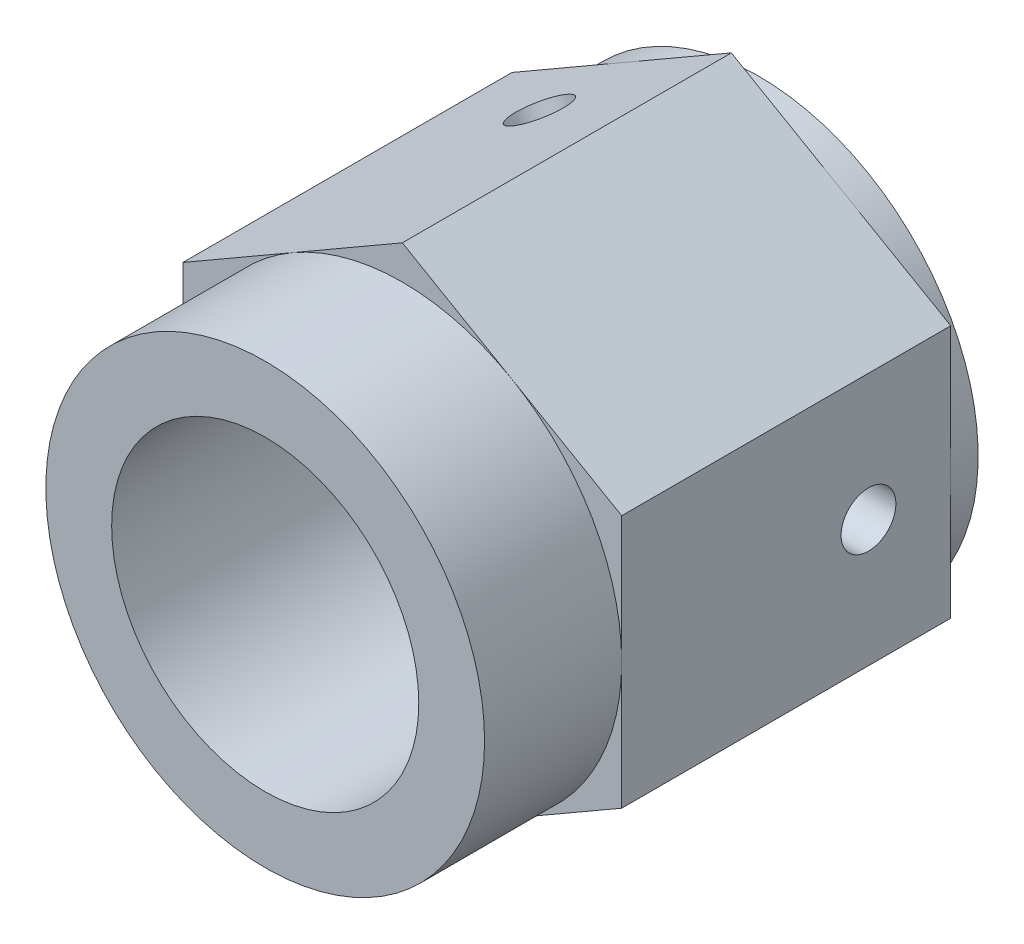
SolidWorks part; units mm, degrees
ref_plane "前视基准面" through (0, 0, 0) normal (0, 0, 1) x (1, 0, 0)
ref_plane "上视基准面" through (0, 0, 0) normal (0, 1, 0) x (1, 0, 0)
ref_plane "右视基准面" through (0, 0, 0) normal (1, 0, 0) x (0, 0, -1)
sketch "草图1" plane through (0, 0, 0) normal (0, 0, 1) x (1, 0, 0)
  line L1 (0, 46.188) -> (-40, 23.094)
  line L2 (-40, 23.094) -> (-40, -23.094)
  line L3 (-40, -23.094) -> (0, -46.188)
  line L4 (0, -46.188) -> (40, -23.094)
  line L5 (40, -23.094) -> (40, 23.094)
  line L6 (40, 23.094) -> (0, 46.188)
  circle A0 centre (0, 0) radius 40 construction
extrude "凸台-拉伸1" add sketch "草图1" along normal blind 60
sketch "草图2" plane through (0, 0, 60) normal (0, 0, 1) x (1, 0, 0)
  circle A0 centre (0, 0) radius 40
extrude "凸台-拉伸2" add sketch "草图2" along normal blind 25
sketch "草图3" plane through (0, 0, 0) normal (0, 0, -1) x (-1, 0, 0)
  circle A0 centre (0, 0) radius 40
extrude "凸台-拉伸3" add sketch "草图3" along normal blind 5
sketch "草图4" plane through (0, 0, -5) normal (0, 0, -1) x (-1, 0, 0)
  circle A0 centre (0, 0) radius 15
extrude "切除-拉伸1" cut sketch "草图4" against normal blind 45
sketch "草图5" plane through (0, 0, 85) normal (0, 0, 1) x (1, 0, 0)
  circle A0 centre (0, 0) radius 28
extrude "切除-拉伸2" cut sketch "草图5" against normal blind 45
sketch "草图6" plane through (-20, 34.641, 0) normal (-0.5, 0.866, 0) x (0.866, 0.5, 0)
  line L0 (0, 0) -> (0, -15) construction
  circle A0 centre (0, -15) radius 5
extrude "切除-拉伸3" cut sketch "草图6" against normal blind 30
sketch "草图7" plane through (-20, -34.641, 0) normal (-0.5, -0.866, 0) x (0.866, -0.5, 0)
  line L0 (0, 0) -> (0, 15) construction
  circle A0 centre (0, 15) radius 5
extrude "切除-拉伸4" cut sketch "草图7" against normal blind 30
sketch "草图8" plane through (40, 0, 0) normal (1, 0, 0) x (0, 0, -1)
  line L0 (0, 0) -> (-15, 0) construction
  circle A0 centre (-15, 0) radius 5
extrude "切除-拉伸5" cut sketch "草图8" against normal blind 30
